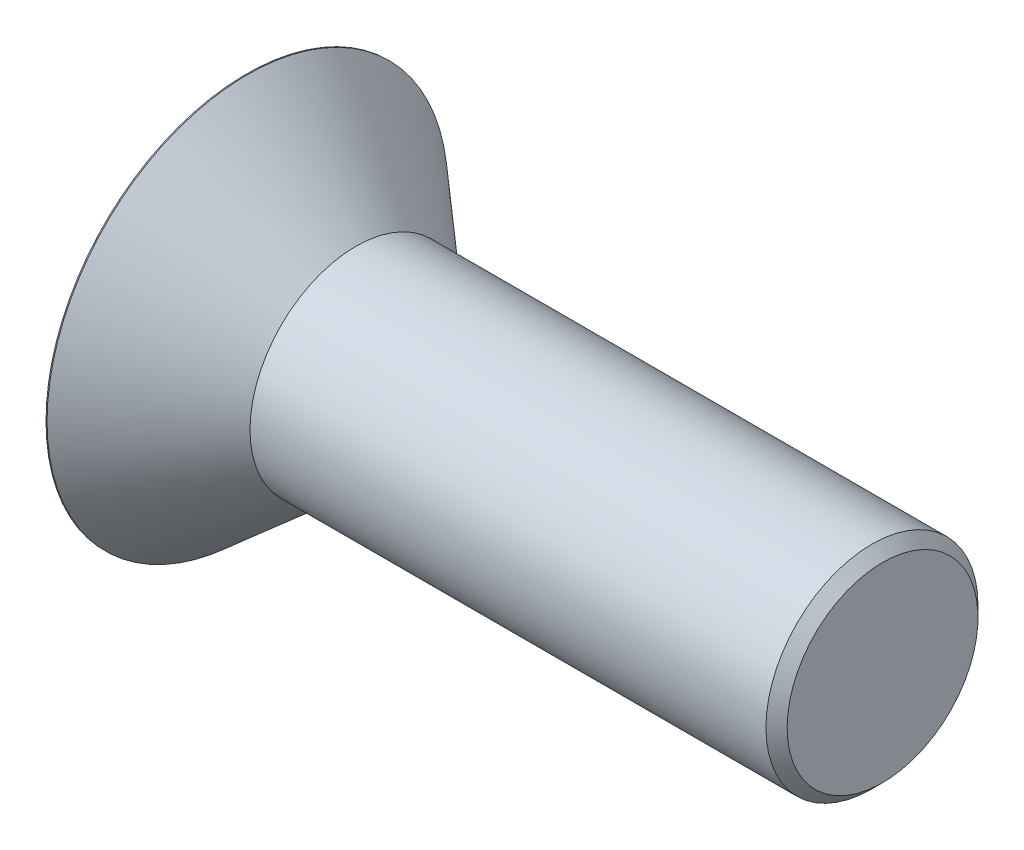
SolidWorks part; units mm, degrees
revolve "PreBroach" cut sketch "Sketch2"
sketch "Sketch2"
  line L0 (0, 7.9375) -> (7.5438, 7.9375)
  line L1 (7.5438, 7.9375) -> (12.1265, 0)
  line L2 (0, 0) -> (127, 0) construction
  line L3 (12.1265, 0) -> (0, 0)
  line L4 (0, 0) -> (0, 7.9375)
  line L5 (0, -7.9375) -> (7.5438, -7.9375) construction
  line L6 (0, 0) -> (47.625, 0) construction
  line L8 (0, 24.003) -> (0, -24.003) construction
revolve "BaseBody" add sketch "BodySke" angle 360 about L6
sketch "BodySke" plane through (0, 0, 0) normal (0, 0, 1) x (1, 0, 0)
  line L0 (0, 0) -> (0, 24.003)
  line L1 (0.127, 24.003) -> (13.1296, 12.7)
  line L2 (0, 24.003) -> (0.127, 24.003)
  line L3 (13.1296, 12.7) -> (74.93, 12.7)
  line L4 (76.2, 11.43) -> (76.2, 0)
  line L5 (76.2, 0) -> (0, 0)
  line L6 (0, 0) -> (127, 0) construction
  line L7 (0.127, -24.003) -> (13.1296, -12.7) construction
  line L8 (76.2, 11.43) -> (74.93, 12.7)
  line L9 (0, -24.003) -> (0.127, -24.003) construction
  line L10 (76.2, -11.43) -> (74.93, -12.7) construction
  line L11 (15.2378, 19.05) -> (15.2378, -3.175) construction
  line L12 (50.8, 19.05) -> (50.8, -3.175) construction
ref_plane "Plane1" through (0, 0, 0) normal (0, 0, 1) x (1, 0, 0)
ref_plane "Plane2" through (0, 0, 0) normal (0, 1, 0) x (1, 0, 0)
ref_plane "Plane3" through (0, 0, 0) normal (1, 0, 0) x (0, 0, -1)
sketch "Sketch3" plane through (0, 0, 0) normal (-1, 0, 0) x (0, 0, 1)
  line L0 (-7.9375, -4.5827) -> (-7.9375, 4.5827)
  line L1 (-7.9375, 4.5827) -> (0, 9.1654)
  line L2 (0, 9.1654) -> (7.9375, 4.5827)
  line L3 (7.9375, 4.5827) -> (7.9375, -4.5827)
  line L4 (7.9375, -4.5827) -> (0, -9.1654)
  line L5 (0, -9.1654) -> (-7.9375, -4.5827)
extrude "Hex" cut sketch "Sketch3" against normal blind 7.5438
sketch "Sketch4" plane through (0, 0, 0) normal (-1, 0, 0) x (0, 0, 1)
  line L0 (0, 0) -> (10.1727, 0)
  line L1 (0, 0) -> (6.1484, 3.5498) construction
  line L2 (0, 0) -> (5.0863, 8.8098)
  line L3 (8.4417, 2.1022) -> (9.7612, 2.864)
  line L4 (6.0414, 6.2596) -> (7.3609, 7.0215)
  arc A0 (8.4417, 2.1022) -> (6.0414, 6.2596) centre (0, 0) ccw
  arc A1 (10.1727, 0) -> (9.7612, 2.864) centre (0, 0) ccw
  arc A2 (5.0863, 8.8098) -> (7.3609, 7.0215) centre (0, 0) cw
extrude "Spline" [suppressed] cut sketch "Sketch4" against normal blind 7.5438
pattern_circular "CirPattern1" [suppressed] count 6 every 60 about axis through (0, 0, 0) along (1, 0, 0)
sketch "ThdSchSke" plane through (0, 0, 0) normal (0, 0, 1) x (1, 0, 0)
  line L0 (50.8, -11.43) -> (49.9108, -12.7)
  line L1 (50.8, -11.43) -> (51.6893, -12.7)
  line L2 (51.6893, -12.7) -> (51.6893, -15.875)
  line L3 (-3.175, 0) -> (5.1513, 0) construction
  line L4 (0, 24.003) -> (0, -24.003) construction
  line L5 (51.6893, -15.875) -> (49.9108, -15.875)
  line L6 (49.9108, -15.875) -> (49.9108, -12.7)
revolve "ThreadSchematic" [suppressed] cut sketch "ThdSchSke" angle 360 about L3
pattern_linear "ThdSchPat" [suppressed]
equation "\"D3@Sketch4\" = \"Spline_p_dim@Sketch4\" / 2"
equation "\"Thread_minor@ThreadCosmetic\"  =  \"Minor_dia@BodySke\""
equation "\"D2@CirPattern1\" = 360 / \"Num_teeth@CirPattern1\""
equation "\"D1@Sketch3\" = \"Hex_size@Sketch3\" / 2"
equation "\"D2@Sketch3\" = \"D1@Sketch3\""
equation "\"D3@Sketch3\" = \"Hex_size@Sketch3\""
equation "\"Thread_length@ThreadCosmetic\" = ((sgn( (\"Length@BodySke\" - \"Advance@BodySke\" - ( ( ( \"Head_dia@BodySke\" - \"Diameter@BodySke\" ) * 0.5 ) / tan( \"Head_ang@BodySke\" * 0.008726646 ) ) ) - \"Thread_nom@Body"
equation "\"Thread_minor@ThdSchSke\" = \"Minor_dia@BodySke\""
equation "\"Diameter@ThdSchSke\" = \"Diameter@BodySke\""
equation "\"Overcut@ThdSchSke\" = \"Diameter@BodySke\" * 1.25"
equation "\"Start@ThdSchSke\" = 0.000001 + \"Length@BodySke\" - \"Thread_length@ThreadCosmetic\"  '---Countersunk---"
equation "\"Num_threads@ThdSchPat\" = int( \"Thread_length@ThreadCosmetic\" / \"Advance@BodySke\" + 0.999 )  + 1"
equation "\"Advance@ThdSchPat\" = \"Thread_length@ThreadCosmetic\" /  (\"Num_threads@ThdSchPat\" - 1) 'relax it"
equation "\"Num_threads@ThdSchPat\" = \"Num_threads@ThdSchPat\" - sgn( \"Num_threads@ThdSchPat\" - 1) '---chamfered tips only---"
